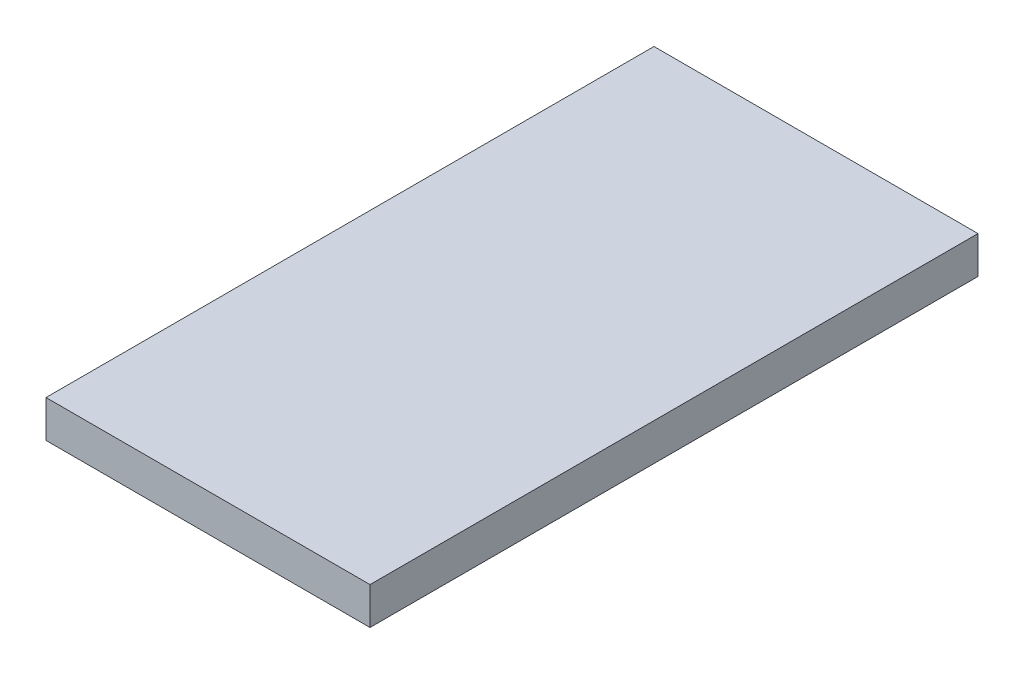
SolidWorks part; units mm, degrees
ref_plane "Front Plane" through (0, 0, 0) normal (0, 0, 1) x (1, 0, 0)
ref_plane "Top Plane" through (0, 0, 0) normal (0, 1, 0) x (1, 0, 0)
ref_plane "Right Plane" through (0, 0, 0) normal (1, 0, 0) x (0, 0, -1)
sketch "Sketch1" plane through (0, 0, 0) normal (0, 1, 0) x (1, 0, 0)
  line L1 (22.66, -42.52) -> (-22.66, -42.52)
  line L2 (22.66, -42.52) -> (22.66, 42.52)
  line L3 (22.66, 42.52) -> (-22.66, 42.52)
  line L4 (-22.66, -42.52) -> (-22.66, 42.52)
  line L5 (22.66, -42.52) -> (-22.66, 42.52) construction
  line L6 (22.66, 42.52) -> (-22.66, -42.52) construction
  point P0 (0, 0)
  dimension "D1" = 45.32
  dimension "D2" = 85.04
extrude "Boss-Extrude1" add sketch "Sketch1" along normal mid plane 5.2 contours L2 L1 L4 L3
